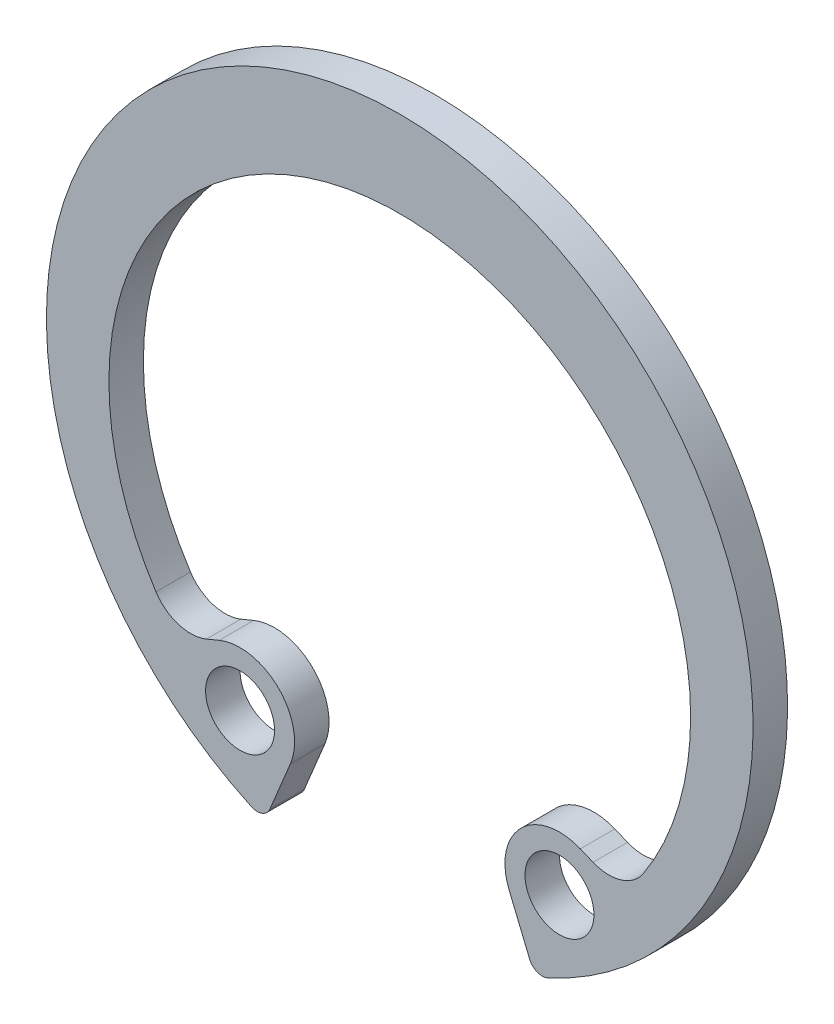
SolidWorks part; units mm, degrees
ref_plane "Front Plane" through (0, 0, 0) normal (0, 0, 1) x (1, 0, 0)
ref_plane "Top Plane" through (0, 0, 0) normal (0, 1, 0) x (1, 0, 0)
ref_plane "Right Plane" through (0, 0, 0) normal (1, 0, 0) x (0, 0, -1)
sketch "BodySke" plane through (0, 0, 0) normal (0, 0, 1) x (1, 0, 0)
  line L0 (0, -7.6074) -> (0, 7.215) construction
  line L1 (3.1716, -7.657) -> (3.9225, -9.4698)
  line L2 (-3.1716, -7.657) -> (-3.9225, -9.4698)
  line L3 (3.9225, -9.4698) -> (7.8743, -9.4698) construction
  line L4 (5.2385, -5.5902) -> (6.4718, -6.1011)
  line L5 (-5.2385, -5.5902) -> (-6.4718, -6.1011)
  arc A0 (3.9225, -9.4698) -> (-3.9225, -9.4698) centre (0, 0) ccw
  arc A1 (0, -9.125) -> (6.1158, -6.5003) centre (0, -0.6875) ccw construction
  circle A2 centre (4.6331, -7.0516) radius 1
  circle A3 centre (0, 0) radius 8.4375 construction
  circle A4 centre (-4.6331, -7.0516) radius 1
  arc A5 (-6.4718, -6.1011) -> (6.4718, -6.1011) centre (0, -0.6875) cw
  arc A6 (6.1158, -6.5003) -> (5.8679, -6.0629) centre (4.6331, -7.0516) ccw construction
  arc A8 (5.2385, -5.5902) -> (3.1716, -7.657) centre (4.6331, -7.0516) ccw
  arc A9 (6.4718, -6.1011) -> (-6.4718, -6.1011) centre (0, -0.6875) ccw
  arc A10 (-5.2385, -5.5902) -> (-3.1716, -7.657) centre (-4.6331, -7.0516) cw
  dimension "D1" = 45
  dimension "Groove_Diameter" = 20.5
  dimension "D2" = 22.5
  dimension "D3" = 16.875
  dimension "Hole_dia" = 2
  dimension "Groove_depth" = 2.5
  dimension "Groove_length" = 4
extrude "BaseBody" add sketch "BodySke" along normal blind 1
fillet "Fillet1" radius 1.2 2 edges at (6.4718, -6.1011, 0.5) (-6.4718, -6.1011, 0.5)
fillet "Fillet2" radius 0.4 2 edges at (3.9225, -9.4698, 0.5) (-3.9225, -9.4698, 0.5)
equation "\"D3@BodySke\" = \"Groove_Diameter@BodySke\" - 1.45 * \"Groove_depth@BodySke\""
equation "\"D1@Fillet1\" = \"Hole_dia@BodySke\" * 0.6"
equation "\"D1@Fillet2\" = \"Hole_dia@BodySke\" * 0.2"
